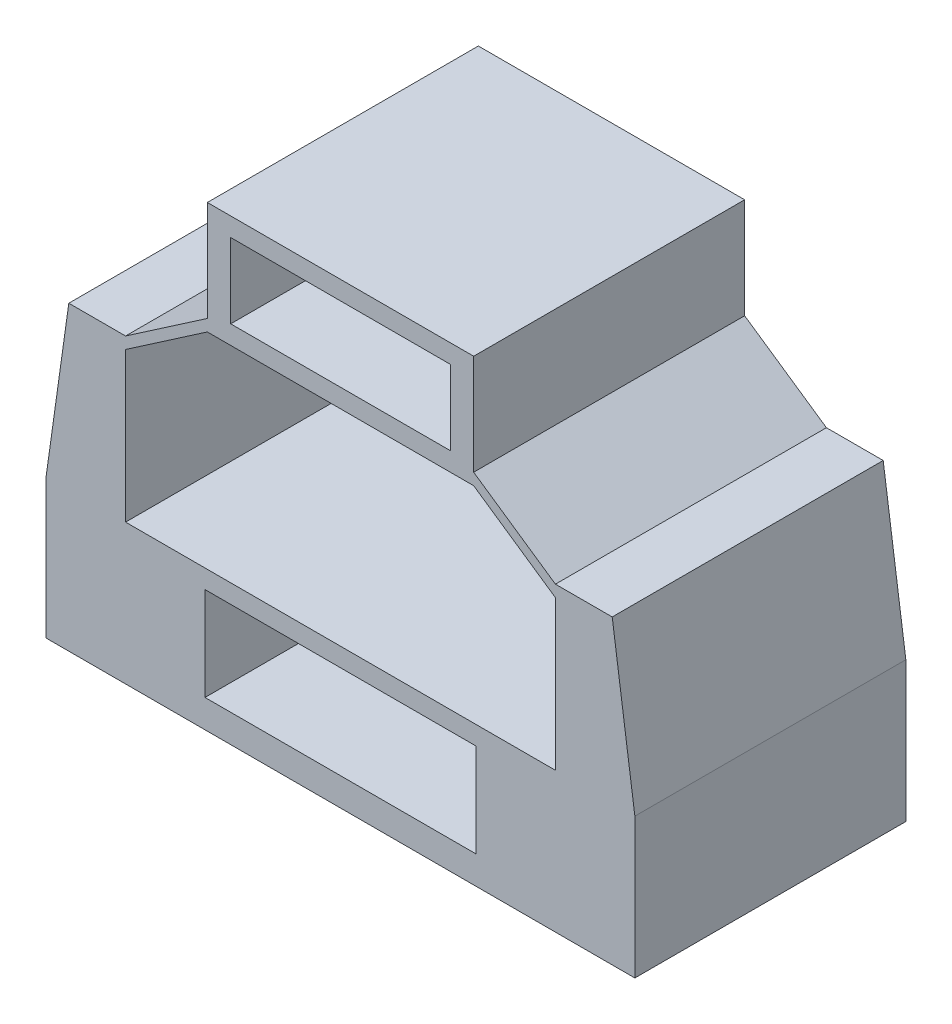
SolidWorks part; units mm, degrees
ref_plane "前视基准面" through (0, 0, 0) normal (0, 0, 1) x (1, 0, 0)
ref_plane "上视基准面" through (0, 0, 0) normal (0, 1, 0) x (1, 0, 0)
ref_plane "右视基准面" through (0, 0, 0) normal (1, 0, 0) x (0, 0, -1)
sketch "Model" plane through (0, 0, 0) normal (0, 0, 1) x (1, 0, 0)
  line L2 (2.9, 0.6) -> (2.9, 2.6)
  line L3 (4.6, 6.2) -> (2.85, 7.4)
  line L4 (4.6, 3) -> (4.6, 6.2)
  line L5 (2.35, 7.8) -> (2.35, 9.4)
  line L6 (2.85, 7.65) -> (4.6, 6.45)
  line L7 (4.6, 6.45) -> (5.8151, 6.45)
  line L8 (5.8151, 6.45) -> (6.3, 3)
  line L9 (6.3, 3) -> (6.3, 0)
  line L10 (2.85, 9.8) -> (2.85, 7.65)
  line L11 (-6.3, 3) -> (-6.3, 0)
  line L12 (-5.8151, 6.45) -> (-6.3, 3)
  line L13 (-4.6, 6.45) -> (-5.8151, 6.45)
  line L14 (-2.85, 7.65) -> (-4.6, 6.45)
  line L15 (-2.85, 9.8) -> (-2.85, 7.65)
  line L16 (2.85, 9.8) -> (-2.85, 9.8)
  line L17 (-2.35, 9.4) -> (2.35, 9.4)
  line L18 (-2.35, 7.8) -> (-2.35, 9.4)
  line L19 (2.35, 7.8) -> (-2.35, 7.8)
  line L20 (-2.85, 7.4) -> (2.85, 7.4)
  line L21 (-4.6, 6.2) -> (-2.85, 7.4)
  line L22 (-4.6, 3) -> (-4.6, 6.2)
  line L23 (4.6, 3) -> (-4.6, 3)
  line L24 (-2.9, 2.6) -> (2.9, 2.6)
  line L25 (-2.9, 0.6) -> (-2.9, 2.6)
  line L26 (2.9, 0.6) -> (-2.9, 0.6)
  line L27 (-6.3, 0) -> (6.3, 0)
  point P29 (0, 0)
extrude "凸台-拉伸1" add sketch "Model" along normal blind 5.8
